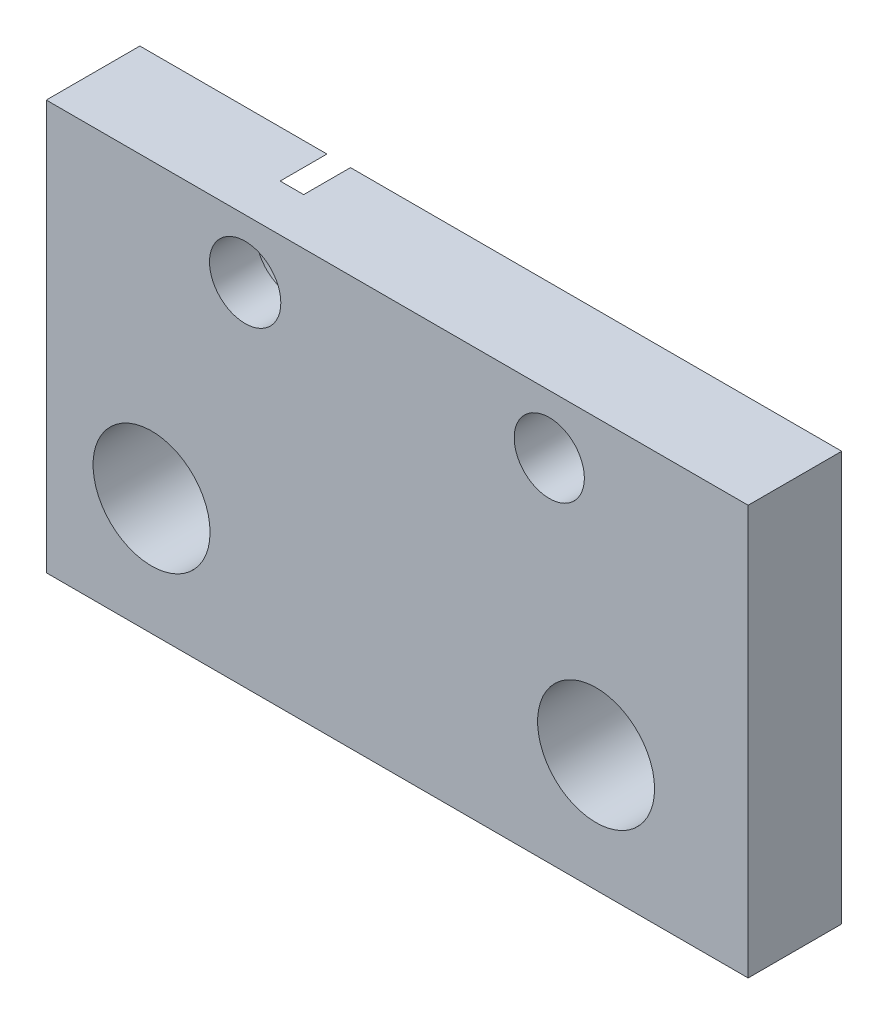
SolidWorks part; units mm, degrees
ref_plane "Plan1" through (0, 0, 0) normal (0, 0, 1) x (1, 0, 0)
ref_plane "Plan2" through (0, 0, 0) normal (0, 1, 0) x (1, 0, 0)
ref_plane "Plan3" through (0, 0, 0) normal (1, 0, 0) x (0, 0, -1)
sketch "Esquisse2" plane through (0, 0, 0) normal (0, 0, 1) x (1, 0, 0)
  line L0 (-30, -10) -> (30, -10)
  line L1 (-30, -10) -> (-30, 25)
  line L2 (30, 25) -> (-30, 25)
  line L3 (30, 25) -> (30, -10)
extrude "Base-Extrusion" add sketch "Esquisse2" along normal blind 8
sketch "Esquisse4" plane through (0, 0, 8) normal (0, 0, 1) x (1, 0, 0)
  line L0 (-33, 20) -> (32, 20) construction
  line L1 (-13, 27) -> (-13, 16) construction
  line L2 (13, 27) -> (13, 16) construction
  line L3 (-33, 0) -> (32, 0) construction
  line L4 (-21, 5) -> (-21, -8) construction
  line L5 (17, 5) -> (17, -6) construction
  line L6 (30, 25) -> (30, -10) construction
  circle A0 centre (-13, 20) radius 3.05
  circle A1 centre (13, 20) radius 3
  circle A2 centre (-21, 0) radius 5
  circle A3 centre (17, 0) radius 5
  dimension "D1" = 6
  dimension "D2" = 13
extrude "Enlèv. mat.-Extru.1" cut sketch "Esquisse4" against normal blind 8
sketch "Esquisse5" plane through (0, 0, 0) normal (0, 0, -1) x (-1, 0, 0)
  circle A0 centre (13, 20) radius 5.1
  dimension "D1" = 10.2
extrude "Enlèv. mat.-Extru.2" cut sketch "Esquisse5" against normal blind 4
